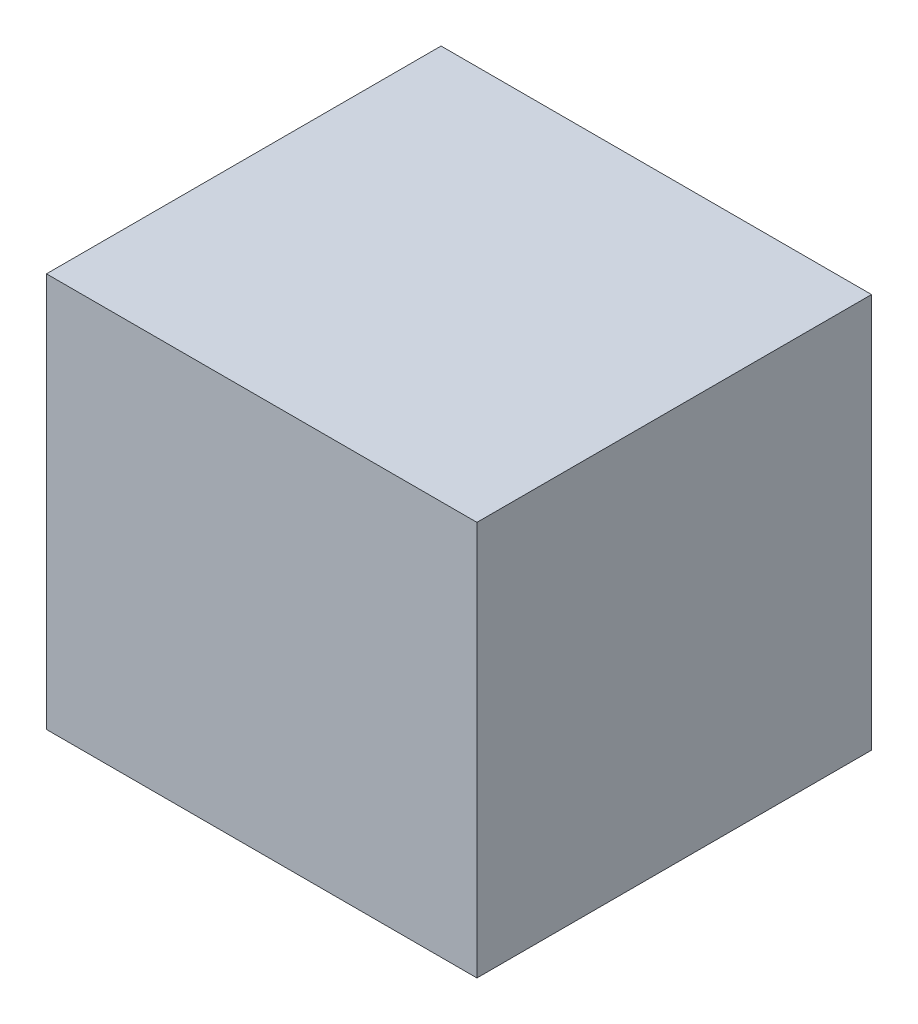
SolidWorks part; units mm, degrees
ref_plane "Front Plane" through (0, 0, 0) normal (0, 0, 1) x (1, 0, 0)
ref_plane "Top Plane" through (0, 0, 0) normal (0, 1, 0) x (1, 0, 0)
ref_plane "Right Plane" through (0, 0, 0) normal (1, 0, 0) x (0, 0, -1)
sketch "Sketch1" plane through (0, 0, 0) normal (1, 0, 0) x (0, 0, -1)
  line L1 (0, 0) -> (110, 0)
  line L2 (0, 0) -> (0, 110)
  line L3 (0, 110) -> (110, 110)
  line L4 (110, 0) -> (110, 110)
  dimension "D1" = 110
  dimension "D2" = 110
extrude "Boss-Extrude1" add sketch "Sketch1" along normal blind 120 contours L1 L4 L3 L2
